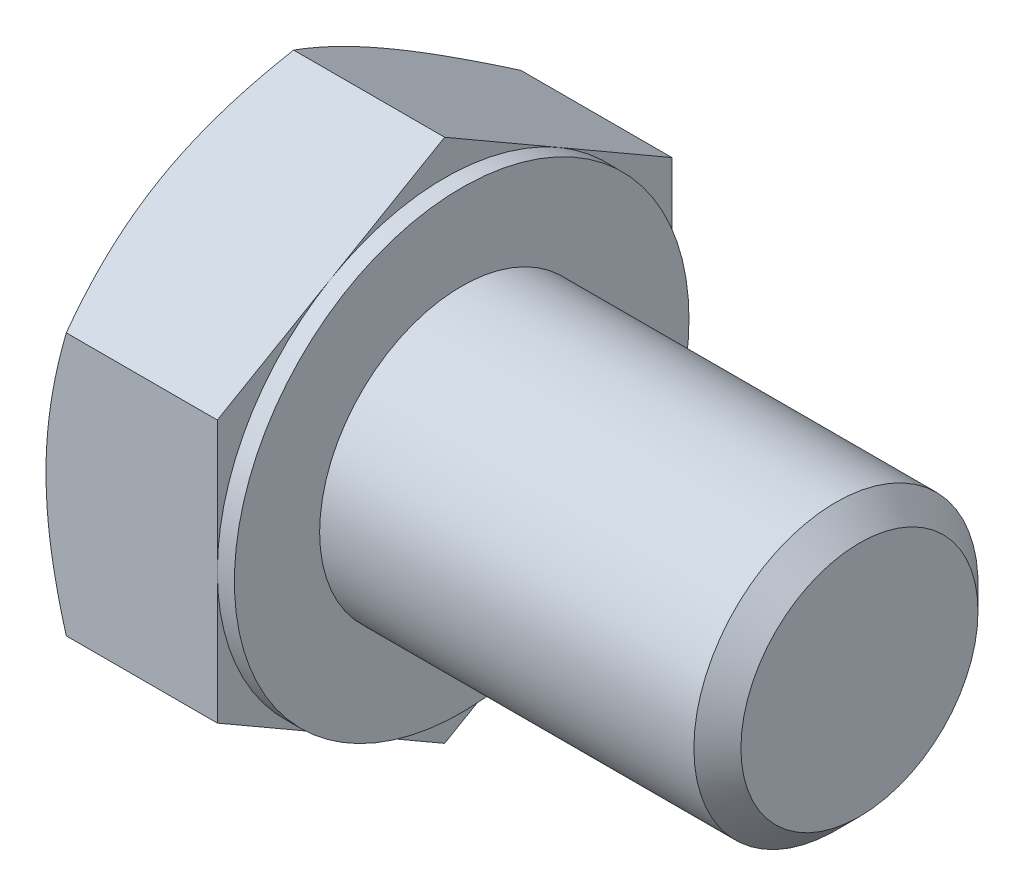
SolidWorks part; units mm, degrees
extrude "BaseHead" add sketch "Sketch1" along normal blind 6.63
sketch "Sketch1" plane through (0, 0, 0) normal (1, 0, 0) x (0, 0, -1)
  line L0 (8, 4.6188) -> (8, -4.6188)
  line L1 (-8, 4.6188) -> (-8, -4.6188)
  line L2 (8, -4.6188) -> (0, -9.2376)
  line L3 (0, -9.2376) -> (-8, -4.6188)
  line L4 (8, 4.6188) -> (0, 9.2376)
  line L5 (0, 9.2376) -> (-8, 4.6188)
revolve "HeadChamfer" cut sketch "Sketch3" angle 360 about L6
sketch "Sketch3" plane through (0, 0, 0) normal (0, 0, 1) x (1, 0, 0)
  line L0 (0, 8) -> (3.6013, 14.2376)
  line L1 (0, 9.2376) -> (0, 4.6188) construction
  line L2 (3.6013, 14.2376) -> (3.6013, 19.2376)
  line L3 (3.6013, 19.2376) -> (-10, 19.2376)
  line L4 (-10, 19.2376) -> (-10, 8)
  line L5 (-10, 8) -> (0, 8)
  line L6 (0, 0) -> (99.06, 0) construction
  line L7 (6.63, 9.2376) -> (0, 9.2376) construction
ref_plane "Plane1" through (0, 0, 0) normal (0, 0, 1) x (1, 0, 0)
ref_plane "Plane2" through (0, 0, 0) normal (0, 1, 0) x (1, 0, 0)
ref_plane "Plane3" through (0, 0, 0) normal (1, 0, 0) x (0, 0, -1)
other "Configuration Table"
sketch "BodySke" plane through (0, 0, 0) normal (0, 0, 1) x (1, 0, 0)
  line L0 (0, 4.6188) -> (0, -4.6188) construction
  line L1 (0, 0) -> (20.63, 0)
  line L2 (0, 0) -> (0, 5)
  line L3 (0, 5) -> (19.802, 5)
  line L4 (20.63, 0) -> (20.63, 4.172)
  line L5 (6.63, 9.2376) -> (6.63, 4.6188) construction
  line L6 (20.63, 4.172) -> (19.802, 5)
  line L7 (0, 0) -> (96.52, 0) construction
  line L8 (20.63, -4.172) -> (19.802, -5) construction
  line L9 (0, -5) -> (19.802, -5) construction
  line L10 (8.13, 15.24) -> (8.13, -1.27) construction
  line L11 (6.63, 15.24) -> (6.63, -1.27) construction
  line L12 (6.63, 4.6188) -> (6.63, -4.6188) construction
revolve "BaseBody" add sketch "BodySke"
fillet "HeadFillet" [suppressed] radius 0.4
sketch "Sketch6" plane through (0, 0, 0) normal (-1, 0, 0) x (0, 0, 1)
  circle A0 centre (0.0332, 0.1924) radius 7
extrude "Indent" cut sketch "Sketch6" against normal blind 0.8287
sketch "Sketch5" plane through (0, 0, 0) normal (0, 0, 1) x (1, 0, 0)
  line L0 (6.63, 8) -> (3.0287, 14.2376)
  line L1 (6.63, 9.2376) -> (6.63, 4.6188) construction
  line L2 (3.0287, 14.2376) -> (3.0287, 19.2376)
  line L3 (3.0287, 19.2376) -> (13.0287, 19.2376)
  line L4 (13.0287, 19.2376) -> (13.0287, 8)
  line L5 (13.0287, 8) -> (6.63, 8)
  line L7 (6.63, 9.2376) -> (0.7145, 9.2376) construction
  line L8 (0, 0) -> (99.06, 0) construction
  line L9 (0, 0) -> (99.06, 0) construction
revolve "UnderHeadChamfer" [suppressed] cut sketch "Sketch5" angle 360 about L8
sketch "Sketch4" plane through (0, 0, 0) normal (0, 0, 1) x (1, 0, 0)
  line L1 (6.63, 9.2376) -> (6.63, 4.6188) construction
  line L2 (6.63, 8) -> (6.03, 8)
  line L3 (6.63, 8) -> (6.63, 19.2376)
  line L4 (6.63, 19.2376) -> (6.03, 19.2376)
  line L5 (0, 0) -> (95.25, 0) construction
  line L6 (0, 0) -> (96.52, 0) construction
  line L7 (6.03, 8) -> (6.03, 19.2376)
  line L8 (6.63, 9.2376) -> (0.7145, 9.2376) construction
revolve "BearingFace" cut sketch "Sketch4" angle 360 about L5
sketch "ThdSchSke" plane through (0, 0, 0) normal (0, 0, 1) x (1, 0, 0)
  line L0 (8.13, -4.172) -> (7.5502, -5)
  line L1 (8.13, -4.172) -> (8.7098, -5)
  line L2 (8.7098, -5) -> (8.7098, -6.25)
  line L3 (-3.175, 0) -> (5.1513, 0) construction
  line L5 (8.7098, -6.25) -> (7.5502, -6.25)
  line L6 (7.5502, -6.25) -> (7.5502, -5)
revolve "ThreadSchematic" [suppressed] cut sketch "ThdSchSke" angle 360 about L3
pattern_linear "ThdSchPat" [suppressed]
equation "\"D3@Sketch1\" = \"Width_flats@Sketch1\" / 2"
equation "\"D4@Sketch1\" = \"D3@Sketch1\""
equation "\"D5@Sketch1\" = \"D4@Sketch1\""
equation "\"Thread_minor@ThreadCosmetic\" = \"Minor_dia@BodySke\""
equation "\"D1@Sketch3\" = \"Width_flats@Sketch1\" / 2"
equation "\"D1@Sketch5\" = \"Width_flats@Sketch1\" / 2"
equation "\"Head_ch_ang@Sketch5\" = \"Head_ch_ang@Sketch3\""
equation "\"D1@Sketch4\" = \"Width_flats@Sketch1\""
equation "\"D1@Sketch6\" = \"Width_flats@Sketch1\" * 7/8"
equation "\"D1@Indent\" = \"Head_ht@BaseHead\" / 8"
equation "\"Thread_length@ThreadCosmetic\" = ((sgn( (\"Length@BodySke\" - \"Advance@BodySke\" ) - \"Thread_nom@BodySke\" )-1)*( (\"Length@BodySke\" - \"Advance@BodySke\" ) - \"Thread_nom@BodySke\" ))/-2+ \"Thread_nom@BodySke\""
equation "\"Thread_minor@ThdSchSke\" = \"Minor_dia@BodySke\""
equation "\"Diameter@ThdSchSke\" = \"Diameter@BodySke\""
equation "\"Overcut@ThdSchSke\" = \"Diameter@BodySke\" * 1.25"
equation "\"Start@ThdSchSke\" = \"Head_ht@BaseHead\" + \"Length@BodySke\" - \"Thread_length@ThreadCosmetic\"  '---Non-countersunk---"
equation "\"Num_threads@ThdSchPat\" = int( \"Thread_length@ThreadCosmetic\" / \"Advance@BodySke\" + 0.999 )  + 1"
equation "\"Advance@ThdSchPat\" = \"Thread_length@ThreadCosmetic\" /  (\"Num_threads@ThdSchPat\" - 1) 'relax it"
equation "\"Num_threads@ThdSchPat\" = \"Num_threads@ThdSchPat\" - sgn( \"Num_threads@ThdSchPat\" - 1) '---chamfered tips only---"
